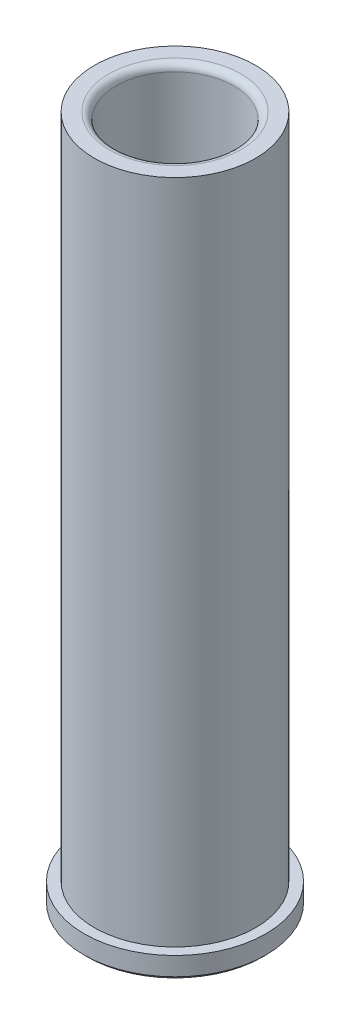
SolidWorks part; units mm, degrees
ref_plane "Front Plane" through (0, 0, 0) normal (0, 0, 1) x (1, 0, 0)
ref_plane "Top Plane" through (0, 0, 0) normal (0, 1, 0) x (1, 0, 0)
ref_plane "Right Plane" through (0, 0, 0) normal (1, 0, 0) x (0, 0, -1)
sketch "Sketch1" plane through (0, 0, 0) normal (0, 0, 1) x (1, 0, 0)
  line L0 (-18.9484, 0) -> (-19.7104, 0.762)
  line L1 (0, -1000) -> (0, 49000) construction
  line L2 (-12.7635, 149.225) -> (-12.7635, 0.762)
  line L3 (-13.5255, 0) -> (-18.9484, 0)
  line L4 (-19.7104, 0.762) -> (-19.7104, 4.7625)
  line L5 (-19.7104, 4.7625) -> (-17.4688, 4.7625)
  line L6 (-17.4688, 149.225) -> (-17.4688, 4.7625)
  line L7 (-17.4688, 149.225) -> (-12.7635, 149.225)
  line L8 (-13.5255, 0) -> (-12.7635, 0.762)
  dimension "OD" = 34.9377
  dimension "ID" = 25.527
  dimension "H" = 39.4208
  dimension "D2" = 45
  dimension "OVERALL LENGTH" = 149.225
  dimension "D4" = 0.762
  dimension "D5" = 135
  dimension "T" = 4.7625
revolve "Revolve1" add sketch "Sketch1" angle 360 about L1
fillet "Fillet1" radius 1.524 1 edges at (12.7635, 149.225, 0)
